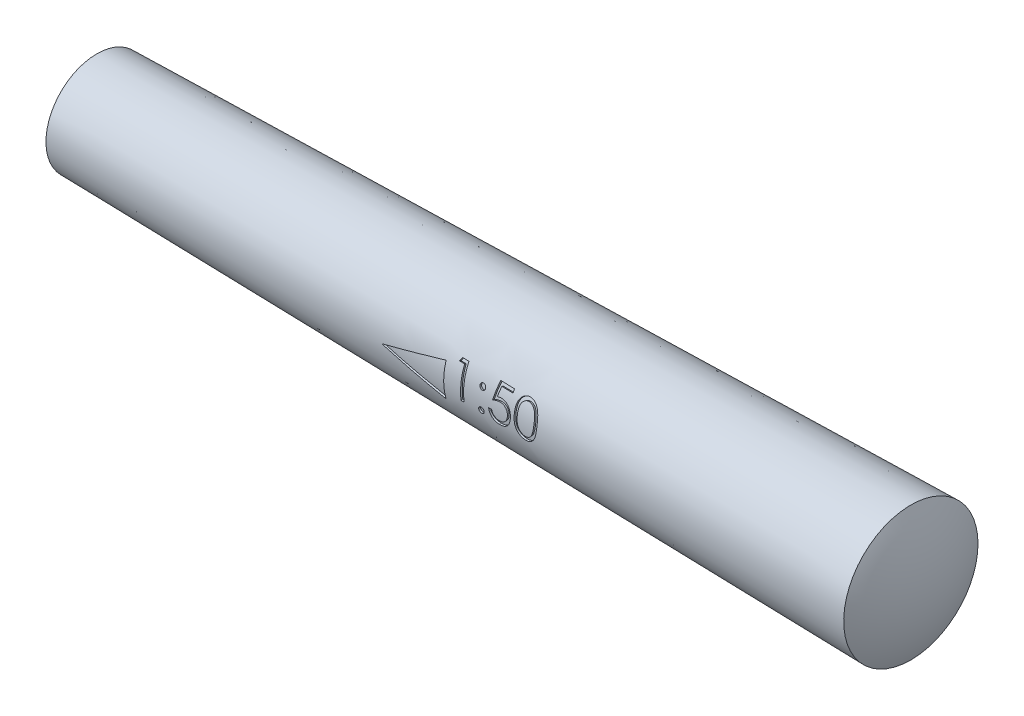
SolidWorks part; units mm, degrees
ref_plane "Front Plane" through (0, 0, 0) normal (0, 0, 1) x (1, 0, 0)
ref_plane "Top Plane" through (0, 0, 0) normal (0, 1, 0) x (1, 0, 0)
ref_plane "Right Plane" through (0, 0, 0) normal (1, 0, 0) x (0, 0, -1)
sketch "Sketch1" plane through (0, 0, 0) normal (1, 0, 0) x (0, 0, -1)
  circle A0 centre (0, 0) radius 1.5
  dimension "D1" = 3
extrude "Extrude1" add sketch "Sketch1" along normal mid plane 24
draft "Draft1" type of draft neutral plane draft angle 1.146 faces to draft 1 parameters "D1"=1.146
sketch "Sketch2" plane through (0, 0, 0) normal (0, 0, 1) x (1, 0, 0)
  line L0 (-12, 0) -> (-12, 1.5)
  line L1 (-12, 1.5) -> (-12, -1.5) construction
  line L2 (-12, 0) -> (-12.45, 0)
  line L3 (-12.45, 0) -> (-12.45, -1.74) construction
  line L4 (12, 0) -> (12, 1.98)
  line L5 (12, -1.98) -> (12, 1.98) construction
  line L6 (12, 0) -> (12.45, 0)
  line L7 (12.45, 0) -> (12.45, -1.74) construction
  line L8 (-12, -1.5) -> (12, -1.98) construction
  arc A0 (-12.45, 0) -> (-12, 1.5) centre (-9.725, 0) cw
  arc A1 (12.45, 0) -> (12, 1.98) centre (7.8689, 0) ccw
  point P14 (0, -1.74)
revolve "Revolve1" add sketch "Sketch2" angle 360 about L2
sketch "Sketch5" plane through (0, 0, 0) normal (0, 0, 1) x (1, 0, 0)
  line L0 (0, 1.74) -> (0, -1.74) construction
  line L1 (12, 1.98) -> (-12, 1.5) construction
  line L2 (-12, -1.5) -> (12, -1.98) construction
ref_plane "Plane2" through (0, 0, 0) normal (-0.02, 0, 0.9998) x (0.9998, 0, 0.02)
sketch "Sketch6" plane through (0, 0, 0) normal (-0.02, 0, 0.9998) x (0.9998, 0, 0.02)
  line L0 (0, 0) -> (0, 0.5)
  line L1 (0, 1.74) -> (0, -1.74) construction
  line L2 (0, 0.5) -> (-1.866, 0)
  line L3 (-1.866, 0) -> (0, -0.5)
  line L4 (0, -0.5) -> (0, 0)
  line L5 (0, -0.25) -> (3, -0.25) construction
  text T0 "1:50" font "Century Gothic" height 1
  dimension "D1" = 1
  dimension "D2" = 30
  dimension "D3" = 3
wrap "Wrap2" sketch "Sketch6" wrap type deboss source sketch "Sketch6" thickness 0.05 parameters "D1"=0.05
equation "\"D2@Sketch2\" = \"D1@Sketch2\""
